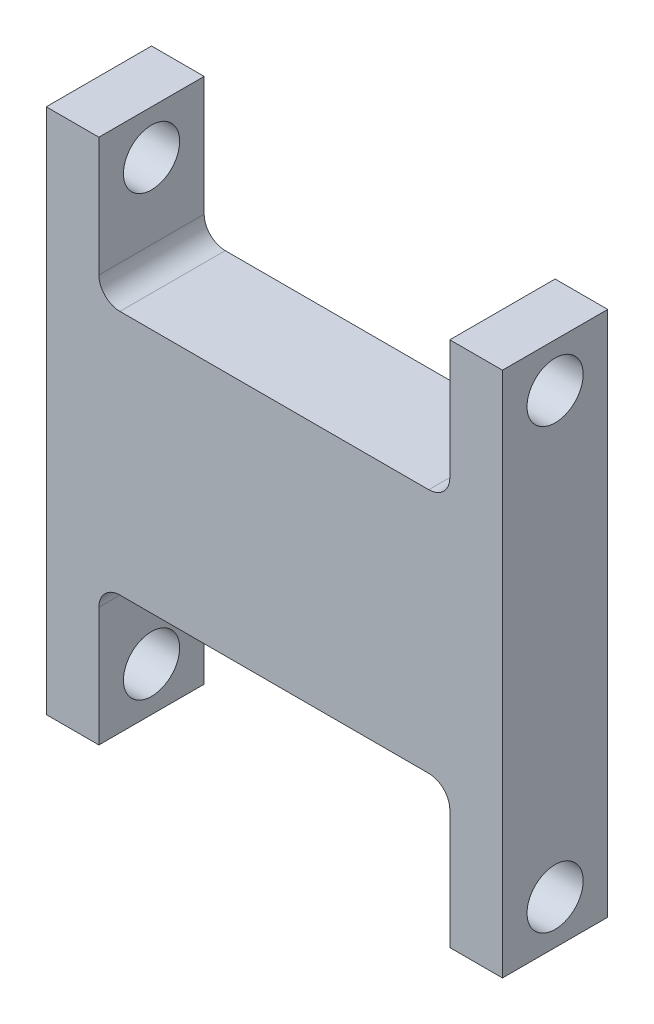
SolidWorks part; units mm, degrees
ref_plane "Face" through (0, 0, 0) normal (0, 0, 1) x (1, 0, 0)
ref_plane "Dessus" through (0, 0, 0) normal (0, 1, 0) x (1, 0, 0)
ref_plane "Droite" through (0, 0, 0) normal (1, 0, 0) x (0, 0, -1)
sketch "Esquisse1" plane through (0, 0, 0) normal (0, 0, 1) x (1, 0, 0)
  line L0 (-44, 35) -> (44, 35)
  line L1 (50, 41) -> (50, 75)
  line L2 (50, 75) -> (65, 75)
  line L3 (65, 75) -> (65, -75)
  line L4 (-50, 41) -> (-50, 75)
  line L5 (-50, 75) -> (-65, 75)
  line L6 (-65, 75) -> (-65, -75)
  line L7 (-122.1097, 0) -> (122.1097, 0) construction
  line L8 (-50, -75) -> (-65, -75)
  line L9 (-50, -41) -> (-50, -75)
  line L10 (50, -75) -> (65, -75)
  line L11 (50, -41) -> (50, -75)
  line L12 (-44, -35) -> (44, -35)
  arc A0 (44, 35) -> (50, 41) centre (44, 41) ccw
  arc A1 (-44, 35) -> (-50, 41) centre (-44, 41) cw
  arc A2 (-50, -41) -> (-44, -35) centre (-44, -41) cw
  arc A3 (50, -41) -> (44, -35) centre (44, -41) ccw
  point P12 (-65, 0)
  point P15 (65, 0)
  point P19 (50, 35)
  point P22 (-50, 35)
  point P25 (-50, -35)
  point P28 (50, -35)
  dimension "D8" = 6
  dimension "D1" = 100
  dimension "D2" = 50
  dimension "D3" = 35
  dimension "D4" = 40
  dimension "D5" = 40
  dimension "D6" = 15
  dimension "D7" = 15
extrude "Extrusion1" add sketch "Esquisse1" along normal mid plane 30
sketch "Esquisse2" plane through (0, 0, 0) normal (1, 0, 0) x (0, 0, -1)
  circle A0 centre (0, 62.5) radius 8
  circle A1 centre (0, -62.5) radius 8
  dimension "D3" = 16
  dimension "D4" = 16
  dimension "D1" = 62.5
  dimension "D2" = 62.5
extrude "Enlèv. mat.-Extru.1" cut sketch "Esquisse2" against normal through all and the other way through all
